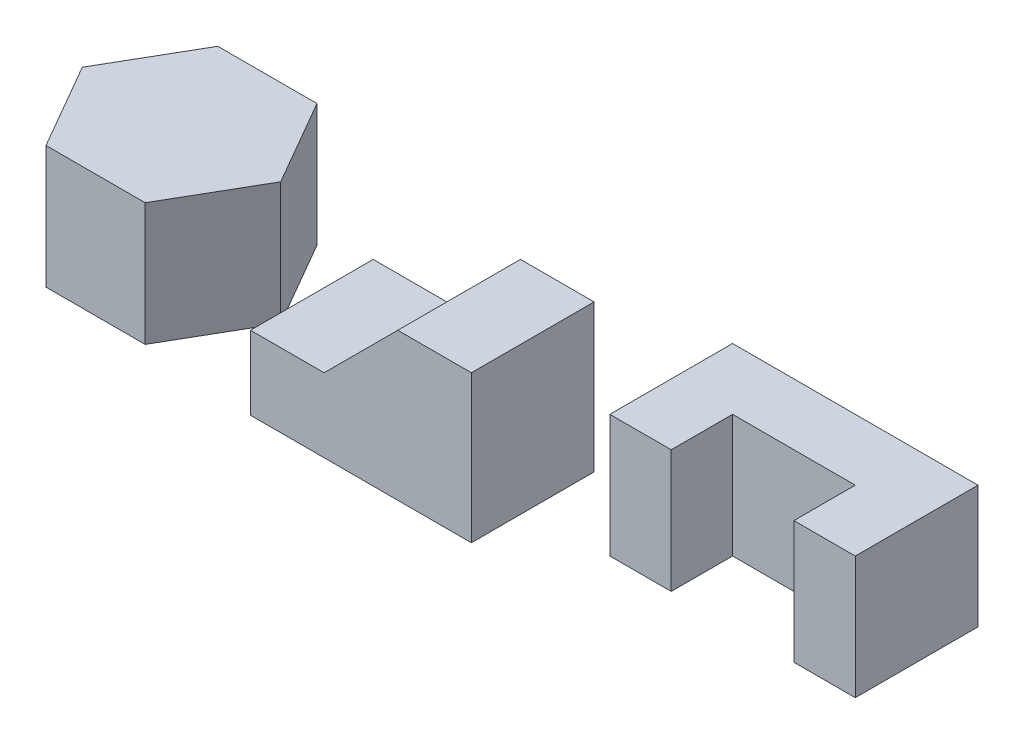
SolidWorks part; units mm, degrees
ref_plane "前视基准面" through (0, 0, 0) normal (0, 0, 1) x (1, 0, 0)
ref_plane "上视基准面" through (0, 0, 0) normal (0, 1, 0) x (1, 0, 0)
ref_plane "右视基准面" through (0, 0, 0) normal (1, 0, 0) x (0, 0, -1)
sketch "草图1" plane through (0, 0, 0) normal (0, 1, 0) x (1, 0, 0)
  line L0 (0, 24.9232) -> (0, -29.3681) construction
  line L1 (-31.273, 0) -> (28.4156, 0) construction
  line L2 (47.9066, 21.7182) -> (47.9066, -17.7182) construction
  line L3 (8.0829, 0) -> (4.0415, 7)
  line L4 (4.0415, 7) -> (-4.0415, 7)
  line L5 (-4.0415, 7) -> (-8.0829, 0)
  line L6 (-8.0829, 0) -> (-4.0415, -7)
  line L7 (-4.0415, -7) -> (4.0415, -7)
  line L8 (4.0415, -7) -> (8.0829, 0)
  line L9 (57.9066, 7) -> (37.9066, 7)
  line L10 (37.9066, 7) -> (37.9066, -3)
  line L11 (37.9066, -3) -> (42.9066, -3)
  line L12 (42.9066, -3) -> (42.9066, 2)
  line L13 (42.9066, 2) -> (52.9066, 2)
  line L14 (52.9066, -3) -> (52.9066, 2)
  line L15 (57.9066, -3) -> (52.9066, -3)
  line L16 (57.9066, 7) -> (57.9066, -3)
  circle A0 centre (0, 0) radius 7 construction
  point P22 (47.9066, 2)
  point P25 (47.9066, 7)
  dimension "D1" = 14
  dimension "D2" = 10
  dimension "D3" = 5
  dimension "D4" = 10
  dimension "D5" = 5
extrude "凸台-拉伸1" add sketch "草图1" along normal blind 10
sketch "草图2" plane through (0, 0, 0) normal (0, 0, 1) x (1, 0, 0)
  line L0 (15.6219, 8.2911) -> (15.6219, 2.2911)
  line L1 (15.6219, 2.2911) -> (33.6219, 2.2911)
  line L2 (33.6219, 2.2911) -> (33.6219, 14.2911)
  line L3 (33.6219, 14.2911) -> (27.6219, 14.2911)
  line L4 (27.6219, 14.2911) -> (21.6219, 8.2911)
  line L5 (21.6219, 8.2911) -> (15.6219, 8.2911)
  dimension "D1" = 18
  dimension "D2" = 6
  dimension "D3" = 12
  dimension "D4" = 6
  dimension "D5" = 6
extrude "凸台-拉伸2" add sketch "草图2" along normal blind 10 separate body
